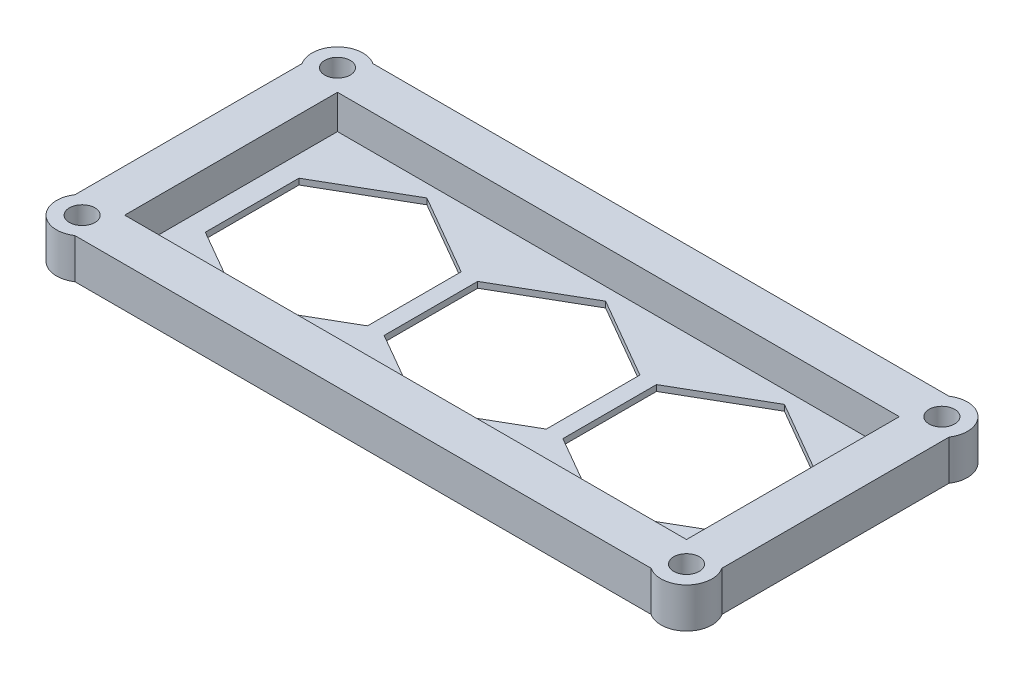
SolidWorks part; units mm, degrees
ref_plane "Plano frontal" through (0, 0, 0) normal (0, 0, 1) x (1, 0, 0)
ref_plane "Plano superior" through (0, 0, 0) normal (0, 1, 0) x (1, 0, 0)
ref_plane "Plano direito" through (0, 0, 0) normal (1, 0, 0) x (0, 0, -1)
sketch "Esboço1" plane through (0, 0, 0) normal (0, 1, 0) x (1, 0, 0)
  line L0 (-41.7904, 19.05) -> (-41.7904, -7.6334)
  line L1 (34.2096, 19.05) -> (34.2096, -7.6334)
  line L4 (17.2096, 16.7083) -> (7.6834, 11.2083)
  line L5 (-37.6321, -11.7917) -> (30.0513, -11.7917)
  line L6 (-3.7904, 16.7083) -> (-13.3166, 11.2083)
  line L7 (-37.6321, 23.2083) -> (30.0513, 23.2083)
  line L12 (-13.3166, 11.2083) -> (-13.3166, 0.2083)
  line L13 (-13.3166, 0.2083) -> (-3.7904, -5.2917)
  line L14 (-3.7904, -5.2917) -> (5.7359, 0.2083)
  line L15 (5.7359, 0.2083) -> (5.7359, 11.2083)
  line L16 (5.7359, 11.2083) -> (-3.7904, 16.7083)
  line L17 (7.6834, 11.2083) -> (7.6834, 0.2083)
  line L18 (7.6834, 0.2083) -> (17.2096, -5.2917)
  line L19 (17.2096, -5.2917) -> (26.7359, 0.2083)
  line L20 (26.7359, 0.2083) -> (26.7359, 11.2083)
  line L21 (26.7359, 11.2083) -> (17.2096, 16.7083)
  line L22 (-24.7904, 16.7083) -> (-34.3166, 11.2083)
  line L23 (-34.3166, 11.2083) -> (-34.3166, 0.2083)
  line L24 (-34.3166, 0.2083) -> (-24.7904, -5.2917)
  line L25 (-24.7904, -5.2917) -> (-15.2641, 0.2083)
  line L26 (-15.2641, 0.2083) -> (-15.2641, 11.2083)
  line L27 (-15.2641, 11.2083) -> (-24.7904, 16.7083)
  circle A0 centre (-39.2904, 20.7083) radius 1.5
  circle A1 centre (-39.2904, -9.2917) radius 1.5
  circle A2 centre (31.7096, -9.2917) radius 1.5
  circle A3 centre (31.7096, 20.7083) radius 1.5
  arc A4 (-37.6321, 23.2083) -> (-41.7904, 19.05) centre (-39.2904, 20.7083) ccw
  arc A5 (34.2096, 19.05) -> (30.0513, 23.2083) centre (31.7096, 20.7083) ccw
  arc A6 (30.0513, -11.7917) -> (34.2096, -7.6334) centre (31.7096, -9.2917) ccw
  arc A7 (-41.7904, -7.6334) -> (-37.6321, -11.7917) centre (-39.2904, -9.2917) ccw
  point P8 (-36.7904, 5.7083)
  point P12 (-36.7904, 16.7083)
  point P15 (-3.7904, 5.7083)
  dimension "D3" = 3
  dimension "D4" = 6
  dimension "D1" = 71
  dimension "D2" = 30
  dimension "D7" = 11
extrude "Ressalto-extrusão1" add sketch "Esboço1" along normal blind 0.7
sketch "Esboço2" plane through (0, 0.7, 0) normal (0, 1, 0) x (1, 0, 0)
  line L0 (-41.7904, 19.05) -> (-41.7904, -7.6334)
  line L2 (-37.6321, -11.7917) -> (30.0513, -11.7917)
  line L6 (34.2096, 19.05) -> (34.2096, -7.6334)
  line L7 (-37.6321, 23.2083) -> (30.0513, 23.2083)
  line L8 (-36.7904, 18.2083) -> (-36.7904, -6.7917)
  line L9 (-36.7904, -6.7917) -> (29.2096, -6.7917)
  line L10 (29.2096, 18.2083) -> (29.2096, -6.7917)
  line L11 (-36.7904, 18.2083) -> (29.2096, 18.2083)
  circle A0 centre (-39.2904, -9.2917) radius 1.5
  arc A1 (-41.7904, -7.6334) -> (-37.6321, -11.7917) centre (-39.2904, -9.2917) ccw
  circle A2 centre (-39.2904, 20.7083) radius 1.5
  arc A3 (-37.6321, 23.2083) -> (-41.7904, 19.05) centre (-39.2904, 20.7083) ccw
  circle A4 centre (31.7096, 20.7083) radius 1.5
  arc A5 (34.2096, 19.05) -> (30.0513, 23.2083) centre (31.7096, 20.7083) ccw
  circle A6 centre (31.7096, -9.2917) radius 1.5
  arc A7 (30.0513, -11.7917) -> (34.2096, -7.6334) centre (31.7096, -9.2917) ccw
extrude "Ressalto-extrusão2" add sketch "Esboço2" along normal blind 4
